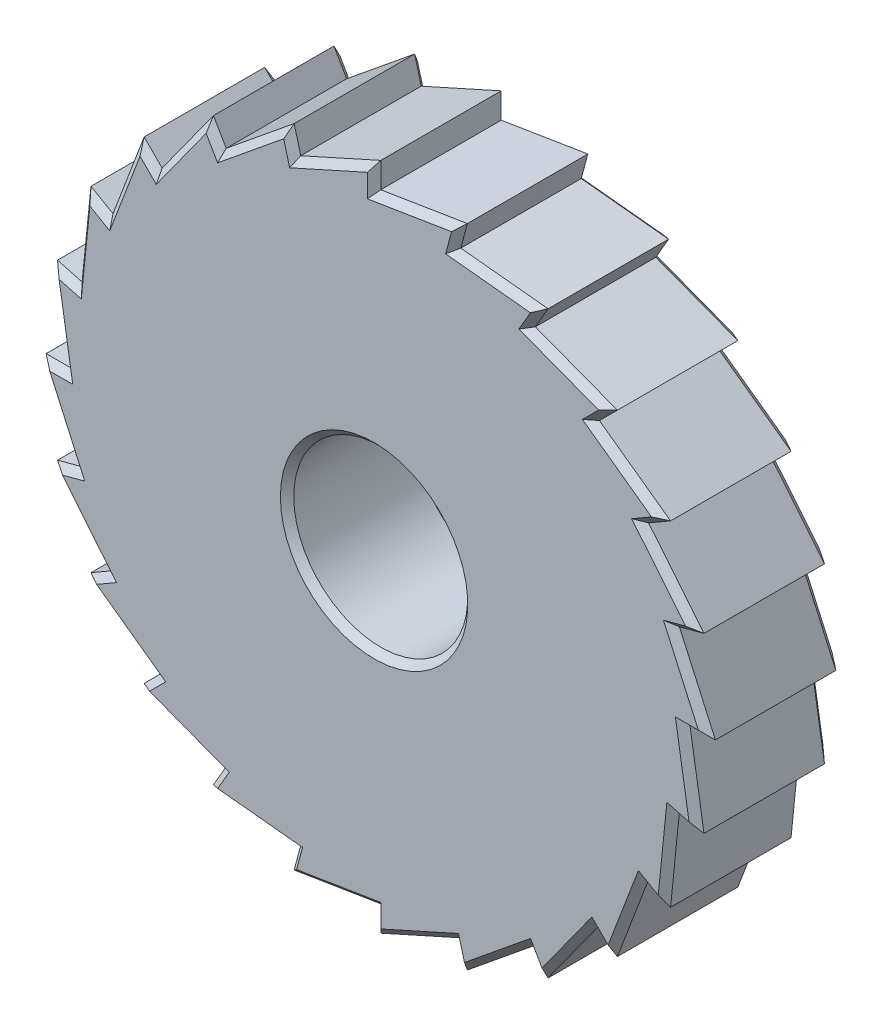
SolidWorks part; units mm, degrees
ref_plane "Спереди" through (0, 0, 0) normal (0, 0, 1) x (1, 0, 0)
ref_plane "Сверху" through (0, 0, 0) normal (0, 1, 0) x (1, 0, 0)
ref_plane "Справа" through (0, 0, 0) normal (1, 0, 0) x (0, 0, -1)
sketch "Эскиз1" plane through (0, 0, 0) normal (0, 0, 1) x (1, 0, 0)
  line L0 (6.4705, 24.1481) -> (5.9787, 22.3129)
  line L1 (-36.2954, 0) -> (44.6244, 0) construction
  line L2 (12.5, 21.6506) -> (11.55, 20.0052)
  line L3 (5.9787, 22.3129) -> (12.5, 21.6506)
  line L4 (17.6777, 17.6777) -> (16.3342, 16.3342)
  line L5 (0, -59.2566) -> (0, 25) construction
  line L6 (11.55, 20.0052) -> (17.6777, 17.6777)
  line L7 (21.6506, 12.5) -> (20.0052, 11.55)
  line L8 (16.3342, 16.3342) -> (21.6506, 12.5)
  line L9 (0, 0) -> (10.7979, 40.2983) construction
  line L10 (-2.5073, 23.1) -> (2.1173, 23.1) construction
  line L11 (24.1481, 6.4705) -> (22.3129, 5.9787)
  line L12 (0, 23.1) -> (6.4705, 24.1481)
  line L13 (20.0052, 11.55) -> (24.1481, 6.4705)
  line L14 (25, 0) -> (23.1, 0)
  line L15 (22.3129, 5.9787) -> (25, 0)
  line L16 (24.1481, -6.4705) -> (22.3129, -5.9787)
  line L17 (23.1, 0) -> (24.1481, -6.4705)
  line L18 (21.6506, -12.5) -> (20.0052, -11.55)
  line L19 (22.3129, -5.9787) -> (21.6506, -12.5)
  line L20 (17.6777, -17.6777) -> (16.3342, -16.3342)
  line L21 (20.0052, -11.55) -> (17.6777, -17.6777)
  line L22 (12.5, -21.6506) -> (11.55, -20.0052)
  line L23 (16.3342, -16.3342) -> (12.5, -21.6506)
  line L24 (6.4705, -24.1481) -> (5.9787, -22.3129)
  line L25 (11.55, -20.0052) -> (6.4705, -24.1481)
  line L26 (0, -25) -> (0, -23.1)
  line L27 (5.9787, -22.3129) -> (0, -25)
  line L28 (-6.4705, -24.1481) -> (-5.9787, -22.3129)
  line L29 (0, -23.1) -> (-6.4705, -24.1481)
  line L30 (-12.5, -21.6506) -> (-11.55, -20.0052)
  line L31 (-5.9787, -22.3129) -> (-12.5, -21.6506)
  line L32 (-17.6777, -17.6777) -> (-16.3342, -16.3342)
  line L33 (-11.55, -20.0052) -> (-17.6777, -17.6777)
  line L34 (-21.6506, -12.5) -> (-20.0052, -11.55)
  line L35 (-16.3342, -16.3342) -> (-21.6506, -12.5)
  line L36 (-24.1481, -6.4705) -> (-22.3129, -5.9787)
  line L37 (-20.0052, -11.55) -> (-24.1481, -6.4705)
  line L38 (-25, 0) -> (-23.1, 0)
  line L39 (-22.3129, -5.9787) -> (-25, 0)
  line L40 (-24.1481, 6.4705) -> (-22.3129, 5.9787)
  line L41 (-23.1, 0) -> (-24.1481, 6.4705)
  line L42 (-21.6506, 12.5) -> (-20.0052, 11.55)
  line L43 (-22.3129, 5.9787) -> (-21.6506, 12.5)
  line L44 (-17.6777, 17.6777) -> (-16.3342, 16.3342)
  line L45 (-20.0052, 11.55) -> (-17.6777, 17.6777)
  line L46 (-12.5, 21.6506) -> (-11.55, 20.0052)
  line L47 (-16.3342, 16.3342) -> (-12.5, 21.6506)
  line L48 (-6.4705, 24.1481) -> (-5.9787, 22.3129)
  line L49 (-11.55, 20.0052) -> (-6.4705, 24.1481)
  line L50 (0, 25) -> (0, 23.1)
  line L51 (-5.9787, 22.3129) -> (0, 25)
  circle A0 centre (0, 0) radius 6.5
  circle A1 centre (0, 0) radius 23.1 construction
  circle A9 centre (0, 0) radius 25 construction
  dimension "D4" = 24
  dimension "D13" = 50
  dimension "D3" = 13
  dimension "D12" = 15
  dimension "D2" = 1.9
extrude "Бобышка-Вытянуть1" add sketch "Эскиз1" along normal blind 10
chamfer "Фаска1" distance 0.5 angle 45 98 edges at (6.5, 0, 0) (23.2305, 6.2246, 0) (22.0767, 9.0102, 0) (20.8279, 12.025, 0) (18.9924, 14.4171, 0) (17.0059, 17.0059, 0) (14.6138, 18.8414, 0) (12.025, 20.8279, 0) (9.2394, 21.9818, 0) (6.2246, 23.2305, 0) (3.2352, 23.6241, 0) (0, 24.05, 0) (-2.9894, 23.6564, 0) (-6.2246, 23.2305, 0) (-9.0102, 22.0767, 0) (-12.025, 20.8279, 0) (-14.4171, 18.9924, 0) (-17.0059, 17.0059, 0) (-18.8414, 14.6138, 0) (-20.8279, 12.025, 0) (-21.9818, 9.2394, 0) (-23.2305, 6.2246, 0) (-23.6241, 3.2352, 0) (-24.05, 0, 0) (-23.6564, -2.9894, 0) (-23.2305, -6.2246, 0) (-22.0767, -9.0102, 0) (-20.8279, -12.025, 0) (-18.9924, -14.4171, 0) (-17.0059, -17.0059, 0) (-14.6138, -18.8414, 0) (-12.025, -20.8279, 0) (-9.2394, -21.9818, 0) (-6.2246, -23.2305, 0) (-3.2352, -23.6241, 0) (0, -24.05, 0) (2.9894, -23.6564, 0) (6.2246, -23.2305, 0) (9.0102, -22.0767, 0) (12.025, -20.8279, 0) (14.4171, -18.9924, 0) (17.0059, -17.0059, 0) (18.8414, -14.6138, 0) (20.8279, -12.025, 0) (21.9818, -9.2394, 0) (23.2305, -6.2246, 0) (23.6241, -3.2352, 0) (24.05, 0, 0) (23.6564, 2.9894, 0) (6.5, 0, 10) (24.05, 0, 10) (23.6241, -3.2352, 10) (23.2305, -6.2246, 10) (21.9818, -9.2394, 10) (20.8279, -12.025, 10) (18.8414, -14.6138, 10) (17.0059, -17.0059, 10) (14.4171, -18.9924, 10) (12.025, -20.8279, 10) (9.0102, -22.0767, 10) (6.2246, -23.2305, 10) (2.9894, -23.6564, 10) (0, -24.05, 10) (-3.2352, -23.6241, 10) (-6.2246, -23.2305, 10) (-9.2394, -21.9818, 10) (-12.025, -20.8279, 10) (-14.6138, -18.8414, 10) (-17.0059, -17.0059, 10) (-18.9924, -14.4171, 10) (-20.8279, -12.025, 10) (-22.0767, -9.0102, 10) (-23.2305, -6.2246, 10) (-23.6564, -2.9894, 10) (-24.05, 0, 10) (-23.6241, 3.2352, 10) (-23.2305, 6.2246, 10) (-21.9818, 9.2394, 10) (-20.8279, 12.025, 10) (-18.8414, 14.6138, 10) (-17.0059, 17.0059, 10) (-14.4171, 18.9924, 10) (-12.025, 20.8279, 10) (-9.0102, 22.0767, 10) (-6.2246, 23.2305, 10) (-2.9894, 23.6564, 10) (0, 24.05, 10) (3.2352, 23.6241, 10) (6.2246, 23.2305, 10) (9.2394, 21.9818, 10) (12.025, 20.8279, 10) (14.6138, 18.8414, 10) (17.0059, 17.0059, 10) (18.9924, 14.4171, 10) (20.8279, 12.025, 10) (22.0767, 9.0102, 10) (23.2305, 6.2246, 10) (23.6564, 2.9894, 10)
